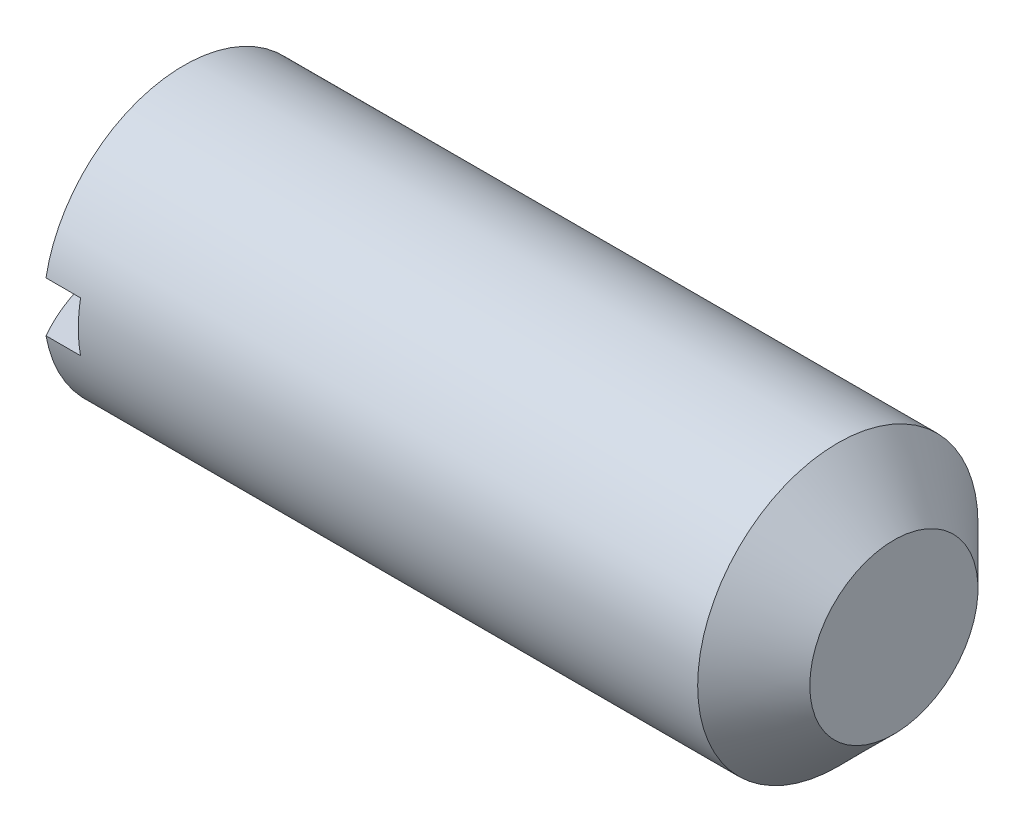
SolidWorks part; units mm, degrees
ref_plane "Plane1" through (0, 0, 0) normal (0, 0, 1) x (1, 0, 0)
ref_plane "Plane2" through (0, 0, 0) normal (0, 1, 0) x (1, 0, 0)
ref_plane "Plane3" through (0, 0, 0) normal (1, 0, 0) x (0, 0, -1)
sketch "BodySke" plane through (0, 0, 0) normal (0, 0, 1) x (1, 0, 0)
  line L0 (2.5522, -9.525) -> (47.1574, -9.525) construction
  line L1 (50.8, 0) -> (50.8, 5.715)
  line L2 (2.5522, 9.525) -> (46.99, 9.525)
  line L3 (50.8, 5.715) -> (46.99, 9.525)
  line L4 (50.8, 0) -> (0, 0)
  line L5 (-12.7, 0) -> (88.9, 0) construction
  line L6 (50.8, 5.715) -> (50.8, 19.05) construction
  line L7 (50.8, -5.715) -> (46.99, -9.525) construction
  line L8 (2.0066, 12.7) -> (2.0066, -3.175) construction
  arc A1 (2.5522, 9.525) -> (0, 0) centre (19.05, 0) ccw
  dimension "Crown_radius" = 19.05
  dimension "Length" = 50.8
  dimension "Diameter" = 19.05
  dimension "Nose_ch_ang" = 45
  dimension "Flat_dia" = 11.43
  dimension "Advance" = 2.0066
revolve "BaseBody" add sketch "BodySke" angle 360 about L5
sketch "Sketch2" plane through (0, 0, 0) normal (1, 0, 0) x (0, 0, -1)
  line L1 (9.525, -1.7018) -> (-9.525, -1.7018)
  line L2 (9.525, -1.7018) -> (9.525, 1.7018)
  line L3 (9.525, 1.7018) -> (-9.525, 1.7018)
  line L4 (-9.525, -1.7018) -> (-9.525, 1.7018)
  dimension "D1" = 19.05
  dimension "D2" = 1.7018
  dimension "Slot_width" = 3.4036
  dimension "D3" = 9.525
extrude "Slot" cut sketch "Sketch2" along normal blind 4.9022
sketch "ThdSchSke" plane through (0, 0, 0) normal (0, 0, 1) x (1, 0, 0)
  line L0 (2.5522, -8.0124) -> (1.4931, -9.525)
  line L1 (2.5522, -8.0124) -> (3.6113, -9.525)
  line L2 (3.6113, -9.525) -> (3.6113, -11.9063)
  line L3 (-3.175, 0) -> (5.1513, 0) construction
  line L4 (2.5522, -9.525) -> (2.5522, -1.7018) construction
  line L5 (3.6113, -11.9063) -> (1.4931, -11.9063)
  line L6 (1.4931, -11.9063) -> (1.4931, -9.525)
  dimension "Thread_minor" = 16.0249
  dimension "Diameter" = 19.05
  dimension "SideAngle" = 55
  dimension "VeeAngle" = 70
  dimension "Overcut" = 23.8125
revolve "ThreadSchematic" [suppressed] cut sketch "ThdSchSke" angle 360 about L3
pattern_linear "ThdSchPat" [suppressed]
equation "\"D1@Sketch2\" = \"Diameter@BodySke\""
equation "\"D3@Sketch2\" = \"D1@Sketch2\" / 2"
equation "\"D2@Sketch2\" = \"Slot_width@Sketch2\" / 2"
equation "\"Thread_minor@ThdSchSke\" = \"Thread_minor@ThreadCosmetic\""
equation "\"Diameter@ThdSchSke\" = \"Diameter@BodySke\""
equation "\"Overcut@ThdSchSke\" = \"Diameter@BodySke\" * 1.25"
equation "\"Num_threads@ThdSchPat\" = int ( ( \"Length@BodySke\" - ( \"Crown_radius@BodySke\" - sqr ( ( \"Crown_radius@BodySke\" * \"Crown_radius@BodySke\" ) - ( ( \"Diameter@BodySke\" * 0.5 ) * ( \"Diameter@BodySke\" * 0.5 "
equation "\"Advance@ThdSchPat\" = ( \"Length@BodySke\" - ( \"Crown_radius@BodySke\" - sqr ( ( \"Crown_radius@BodySke\" * \"Crown_radius@BodySke\" ) - ( ( \"Diameter@BodySke\" * 0.5 ) * ( \"Diameter@BodySke\" * 0.5 ) ) ) ) - "
equation "' \"Num_threads@ThdSchPat\" = \"Num_threads@ThdSchPat\" - sgn( \"Num_threads@ThdSchPat\" - 1) '---chamfered tips only---"
